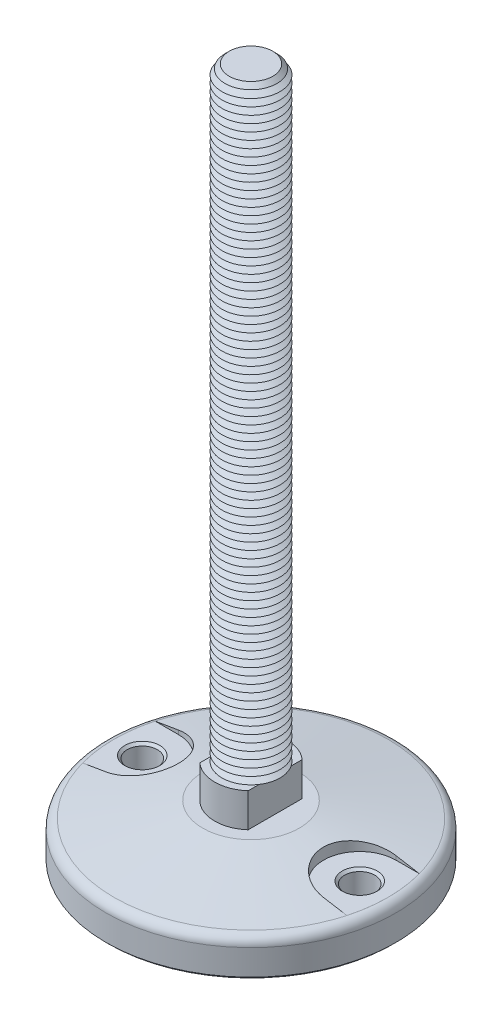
SolidWorks part; units mm, degrees
ref_plane "Front Plane" through (0, 0, 0) normal (0, 0, 1) x (1, 0, 0)
ref_plane "Top Plane" through (0, 0, 0) normal (0, 1, 0) x (1, 0, 0)
ref_plane "Right Plane" through (0, 0, 0) normal (1, 0, 0) x (0, 0, -1)
sketch "Sketch1" plane through (0, 0, 0) normal (1, 0, 0) x (0, 0, -1)
  line L0 (0, 61.3389) -> (0, -58.404) construction
sketch "Sketch2" plane through (0, 0, 0) normal (1, 0, 0) x (0, 0, -1)
  line L0 (0, 0) -> (-20, 0)
  line L1 (-20, 0) -> (-60, -7.0531)
  line L2 (-60, -7.0531) -> (-60, -22)
  line L3 (-60, -22) -> (0, -22)
  line L4 (0, 61.3389) -> (0, -58.404) construction
  line L5 (0, -22) -> (0, 0)
  dimension "D1" = 22
  dimension "D2" = 60
  dimension "D3" = 20
  dimension "D4" = 10
revolve "Revolve1" add sketch "Sketch2" angle 360 about L0
fillet "Fillet1" radius 4 1 edges at (0, -7.0531, 60)
sketch "Sketch3" plane through (0, 0, 0) normal (0, 1, 0) x (1, 0, 0)
  circle A0 centre (0, 0) radius 15
  dimension "D1" = 30
extrude "Boss-Extrude1" add sketch "Sketch3" along normal blind 14
sketch "Sketch4" plane through (0, 14, 0) normal (0, 1, 0) x (1, 0, 0)
  line L0 (-10, 11.1803) -> (-10, -11.1803)
  line L2 (10, -11.1803) -> (10, 11.1803)
  arc A0 (-10, 11.1803) -> (-10, -11.1803) centre (0, 0) ccw
  circle A1 centre (0, 0) radius 15 construction
  arc A2 (10, -11.1803) -> (10, 11.1803) centre (0, 0) ccw
  dimension "D1" = 20
extrude "Cut-Extrude1" cut sketch "Sketch4" against normal blind 14
sketch "Sketch5" plane through (0, 14, 0) normal (0, 1, 0) x (1, 0, 0)
  circle A0 centre (0, 0) radius 12
  dimension "D1" = 24
extrude "Boss-Extrude2" add sketch "Sketch5" along normal blind 250
chamfer "Chamfer1" distance 3 angle 45 1 edges at (0, 264, 12)
sketch "Sketch6" plane through (0, 0, 0) normal (1, 0, 0) x (0, 0, -1)
  line L0 (-12, 14) -> (-9.4019, 15.5)
  line L1 (-9.4019, 15.5) -> (-12, 17)
  line L2 (-12, 261) -> (-12, 14) construction
  line L3 (-12, 17) -> (-12, 14)
  dimension "D1" = 3
revolve "Cut-Revolve1" cut sketch "Sketch6" angle 360 about L0
pattern_linear "LPattern1" count 83 spacing 3 along (0, 1, 0) of "Cut-Revolve1"
sketch "Sketch8" plane through (0, 0, 0) normal (0, 1, 0) x (1, 0, 0)
  line L0 (-45, 15) -> (-54.6743, 15)
  line L1 (-45, -15) -> (-54.6743, -15)
  arc A1 (-54.6743, 15) -> (-54.6743, -15) centre (0, 0) ccw
  circle A2 centre (0, 0) radius 56.6946 construction
  arc A3 (-45, -15) -> (-45, 15) centre (-45, 0) ccw
  point P3 (-45, 0)
  point P11 (0, 0)
  dimension "D1" = 45
  dimension "D2" = 30
extrude "Cut-Extrude4" cut sketch "Sketch8" against normal blind 6.47
sketch "Sketch10" plane through (0, -6.47, 0) normal (0, 1, 0) x (1, 0, 0)
  circle A0 centre (-45, 0) radius 6.25
  dimension "D1" = 12.5
extrude "Cut-Extrude5" cut sketch "Sketch10" against normal up to surface (15.53 mm away)
chamfer "Chamfer2" distance 1 angle 45 2 edges at (-45, -22, -6.25) (-45, -6.47, 6.25)
mirror "Mirror1" about plane through (0, 0, 0) normal (1, 0, 0) of "Chamfer2", "Cut-Extrude5", "Cut-Extrude4"
chamfer "Chamfer3" distance 1 angle 45 1 edges at (0, -22, 60)
